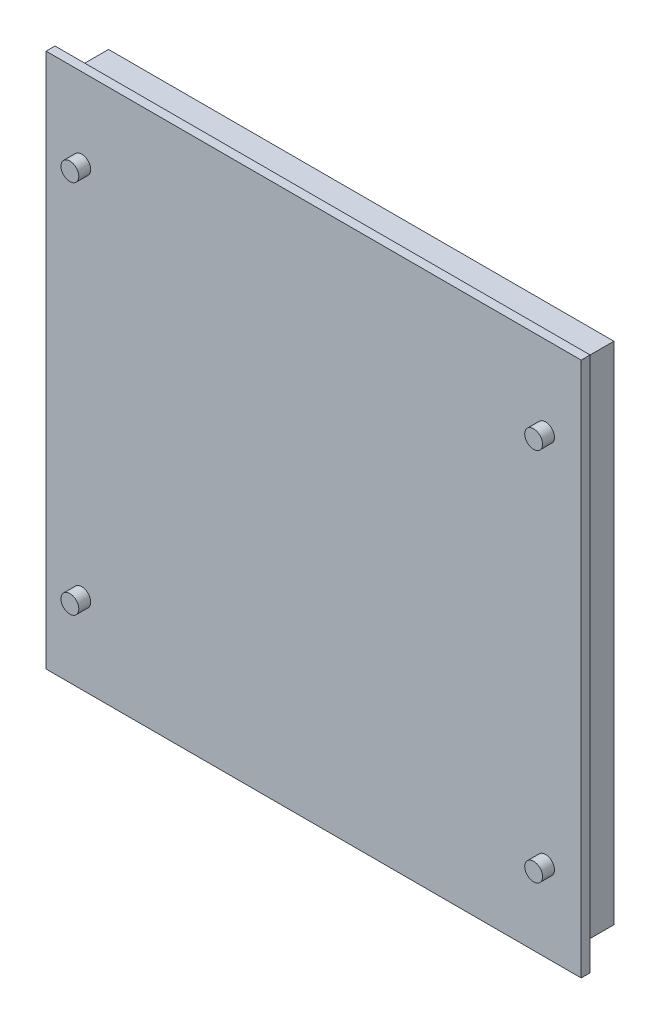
SolidWorks part; units mm, degrees
ref_plane "前视基准面" through (0, 0, 0) normal (0, 0, 1) x (1, 0, 0)
ref_plane "上视基准面" through (0, 0, 0) normal (0, 1, 0) x (1, 0, 0)
ref_plane "右视基准面" through (0, 0, 0) normal (1, 0, 0) x (0, 0, -1)
sketch "草图1" plane through (0, 0, 0) normal (0, 0, 1) x (1, 0, 0)
  line L1 (-90, 90) -> (90, 90)
  line L2 (-90, 90) -> (-90, -90)
  line L3 (-90, -90) -> (90, -90)
  line L4 (90, 90) -> (90, -90)
  line L5 (-90, 90) -> (90, -90) construction
  line L6 (-90, -90) -> (90, 90) construction
  point P0 (0, 0)
  dimension "D1" = 180
  dimension "D2" = 180
extrude "凸台-拉伸1" add sketch "草图1" along normal blind 3
sketch "草图2" plane through (0, 0, 3) normal (0, 0, 1) x (1, 0, 0)
  line L0 (-90, 90) -> (-90, -90) construction
  line L1 (90, 90) -> (-90, 90) construction
  line L2 (90, -90) -> (90, 90) construction
  line L3 (-90, -90) -> (90, -90) construction
  circle A0 centre (-78, 63) radius 3
  circle A1 centre (-78, -63) radius 3
  circle A2 centre (78, -63) radius 3
  circle A3 centre (78, 63) radius 3
  dimension "D1" = 6
  dimension "D2" = 6
  dimension "D3" = 6
  dimension "D4" = 6
  dimension "D6" = 27
  dimension "D5" = 12
  dimension "D7" = 12
  dimension "D8" = 27
  dimension "D9" = 27
  dimension "D10" = 12
  dimension "D11" = 27
  dimension "D12" = 12
extrude "凸台-拉伸2" add sketch "草图2" along normal blind 4
sketch "草图3" plane through (0, 0, 0) normal (0, 0, -1) x (-1, 0, 0)
  line L17 (-85, -85) -> (85, -85)
  line L18 (85, -85) -> (85, 85)
  line L19 (85, 85) -> (-85, 85)
  line L20 (-85, 85) -> (-85, -85)
  line L21 (-85, -85) -> (85, -85)
  line L22 (85, -85) -> (85, 85)
  line L23 (85, 85) -> (-85, 85)
  line L24 (-85, 85) -> (-85, -85)
  dimension "D1" = 5
extrude "凸台-拉伸3" add sketch "草图3" along normal blind 13
sketch "草图4" plane through (0, 0, -13) normal (0, 0, -1) x (-1, 0, 0)
  text T0 "TX2" font "黑体" height 20
extrude "切除-拉伸1" cut sketch "草图4" against normal blind 5
